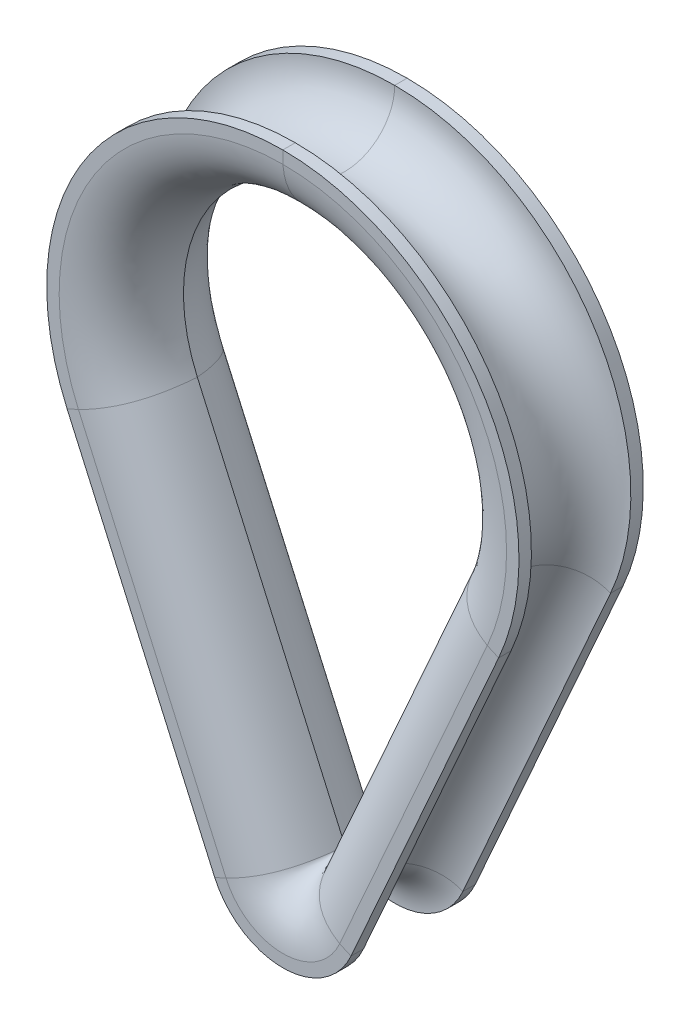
SolidWorks part; units mm, degrees
ref_plane "Front Plane" through (0, 0, 0) normal (0, 0, 1) x (1, 0, 0)
ref_plane "Top Plane" through (0, 0, 0) normal (0, 1, 0) x (1, 0, 0)
ref_plane "Right Plane" through (0, 0, 0) normal (1, 0, 0) x (0, 0, -1)
sketch "Sketch1" plane through (0, 0, 0) normal (0, 0, 1) x (1, 0, 0)
  line L0 (-17.3615, -7.7187) -> (-5.4826, -34.4375)
  line L1 (0, 0) -> (0, -44.6967) construction
  line L3 (17.3615, -7.7187) -> (5.4826, -34.4375)
  arc A1 (17.3615, -7.7187) -> (-17.3615, -7.7187) centre (0, 0) ccw
  arc A2 (-5.4826, -34.4375) -> (5.4826, -34.4375) centre (0, -32) ccw
  dimension "D1" = 19
  dimension "D2" = 6
  dimension "D3" = 32
sketch "Sketch2" plane through (0, 0, 0) normal (1, 0, 0) x (0, 0, -1)
  line L0 (0, 15) -> (0, 13) construction
  line L3 (0, 0) -> (0, 26.5915) construction
  line L15 (-5, 19) -> (-4, 19)
  line L16 (-5, 19) -> (-5, 18)
  line L17 (5, 19) -> (5, 18)
  line L18 (5, 19) -> (4, 19)
  arc A0 (-4, 19) -> (4, 19) centre (0, 19) ccw
  spline S1 degree 2 poles (-5, 18) (-4.654, 13.8066) (0, 13) knots 0 0 0 1 1 1
  spline S2 degree 2 poles (5, 18) (4.654, 13.8066) (0, 13) knots 0 0 0 1 1 1
  point P11 (-3.6281, 15.3294)
  point P15 (0, 0)
  point P16 (-4.9698, 18)
  point P17 (0, 0)
  dimension "D1" = 19
  dimension "D2" = 1
  dimension "D4" = 2
  dimension "D3" = 4
  dimension "D5" = 1
  dimension "D6" = 5.5
  dimension "D7" = 15.5
  dimension "D8" = 5
sweep "Sweep3" add profiles "Sketch2" path "Sketch1"
